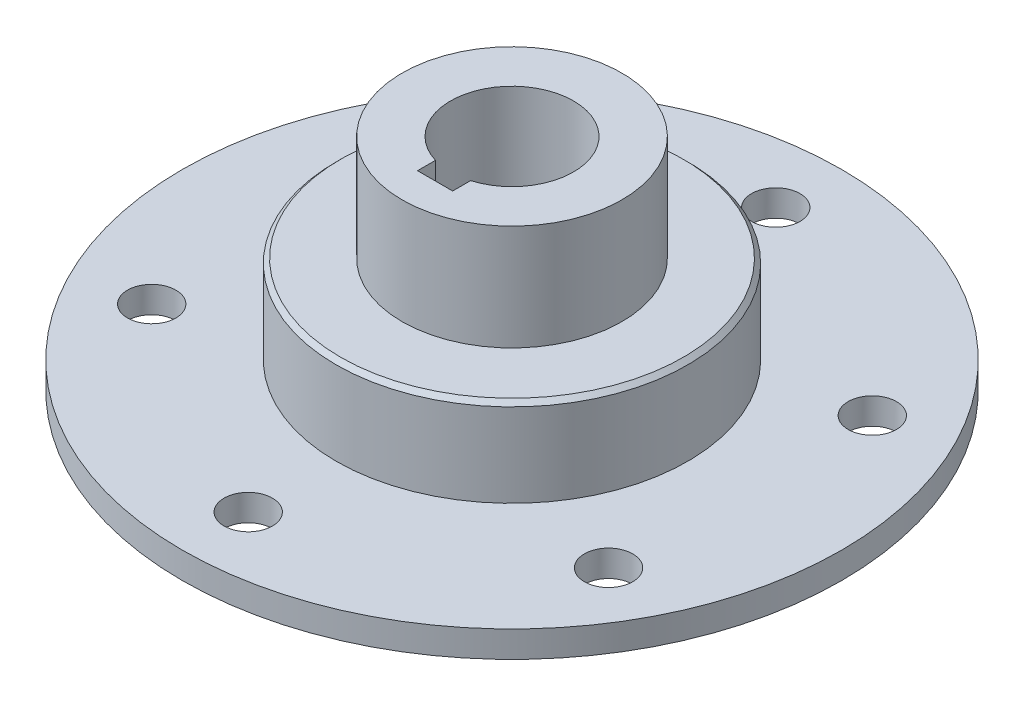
SolidWorks part; units mm, degrees
ref_plane "前视基准面" through (0, 0, 0) normal (0, 0, 1) x (1, 0, 0)
ref_plane "上视基准面" through (0, 0, 0) normal (0, 1, 0) x (1, 0, 0)
ref_plane "右视基准面" through (0, 0, 0) normal (1, 0, 0) x (0, 0, -1)
sketch "草图1" plane through (0, 0, 0) normal (0, 0, 1) x (1, 0, 0)
  line L0 (0, 30) -> (0, -30)
  line L1 (0, -30) -> (-25, -30)
  line L2 (-25, -30) -> (-25, -20)
  line L3 (-25, -20) -> (-75, -20)
  line L4 (-75, -20) -> (-75, -14)
  line L5 (-75, -14) -> (-40, -14)
  line L6 (-25, 6) -> (-25, 30)
  line L7 (-25, 30) -> (0, 30)
  line L8 (-40, -14) -> (-40, 6)
  line L9 (-40, 6) -> (-25, 6)
  dimension "D1" = 60
  dimension "D2" = 6
  dimension "D3" = 25
  dimension "D4" = 75
  dimension "D5" = 10
  dimension "D6" = 20
  dimension "D7" = 40
revolve "旋转1" add sketch "草图1" angle 360 about L0
sketch "草图2" plane through (0, -30, 0) normal (0, -1, 0) x (1, 0, 0)
  line L0 (-4, 13.4164) -> (-4, 17.5)
  line L1 (-4, 17.5) -> (4, 17.5)
  line L2 (4, 17.5) -> (4, 13.4164)
  arc A0 (-4, 13.4164) -> (4, 13.4164) centre (0, 0) ccw
  dimension "D1" = 28
  dimension "D2" = 8
  dimension "D3" = 17.5
extrude "拉伸1" cut sketch "草图2" against normal through all
chamfer "倒角1" distance 1 angle 45 1 edges at (0, 6, 40)
hole_wizard "孔1" positions "草图4" profile "草图3" legacy
sketch "草图4" plane through (0, -14, 0) normal (0, 1, 0) x (-1, 0, 0)
  point P0 (0, 60)
  dimension "D1" = 60
sketch "草图3" plane through (0, -14, 60) normal (1, 0, 0) x (0, 0, 1)
  line L0 (0, 0) -> (0, 16)
  line L1 (0, 16) -> (5.5, 16)
  line L2 (5.5, 16) -> (5.5, 0)
  line L3 (5.5, 0) -> (0, 0)
  line L4 (0, 110) -> (0, -10) construction
  dimension "直径" = 11
  dimension "深度" = 16
pattern_circular "阵列(圆周)1" count 6 over 360 about axis through (0, 0, 0) along (0, 1, 0) of "孔1"
